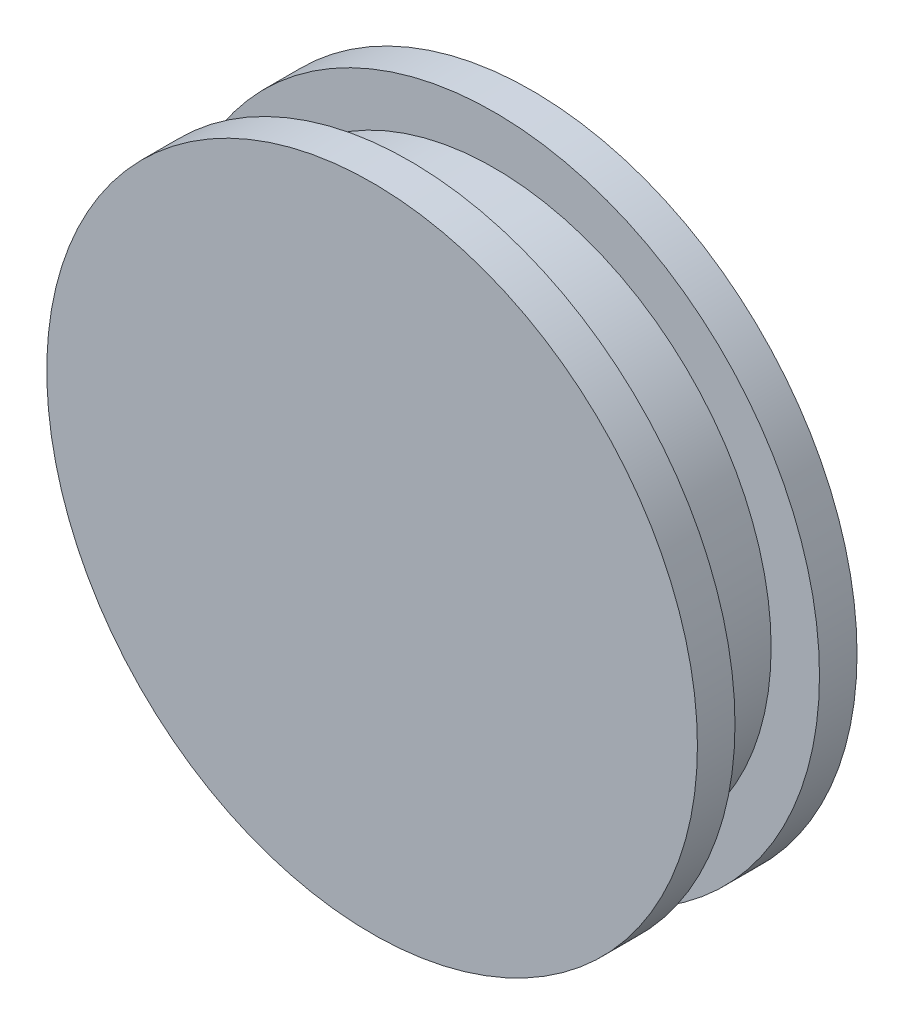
SolidWorks part; units mm, degrees
ref_plane "Front Plane" through (0, 0, 0) normal (0, 0, 1) x (1, 0, 0)
ref_plane "Top Plane" through (0, 0, 0) normal (0, 1, 0) x (1, 0, 0)
ref_plane "Right Plane" through (0, 0, 0) normal (1, 0, 0) x (0, 0, -1)
sketch "Sketch1" plane through (0, 0, 0) normal (0, 1, 0) x (1, 0, 0)
  line L0 (0, 0) -> (8.8011, 0)
  line L1 (8.8011, 0) -> (8.8011, 1.016)
  line L2 (8.8011, 1.016) -> (7.493, 1.016)
  line L3 (7.493, 1.016) -> (7.493, 3.302)
  line L4 (8.8011, 3.302) -> (7.493, 3.302)
  line L5 (0, 0) -> (0, 8.5002) construction
  line L6 (8.8011, 3.302) -> (8.8011, 4.318)
  line L7 (8.8011, 4.318) -> (0, 4.318)
  line L8 (0, 4.318) -> (0, 0)
  dimension "D1" = 8.8011
  dimension "D2" = 1.016
  dimension "D3" = 2.286
  dimension "D4" = 1.016
  dimension "D5" = 7.493
  dimension "D6" = 1.3081
revolve "Revolve1" add sketch "Sketch1" angle 360 about L5
